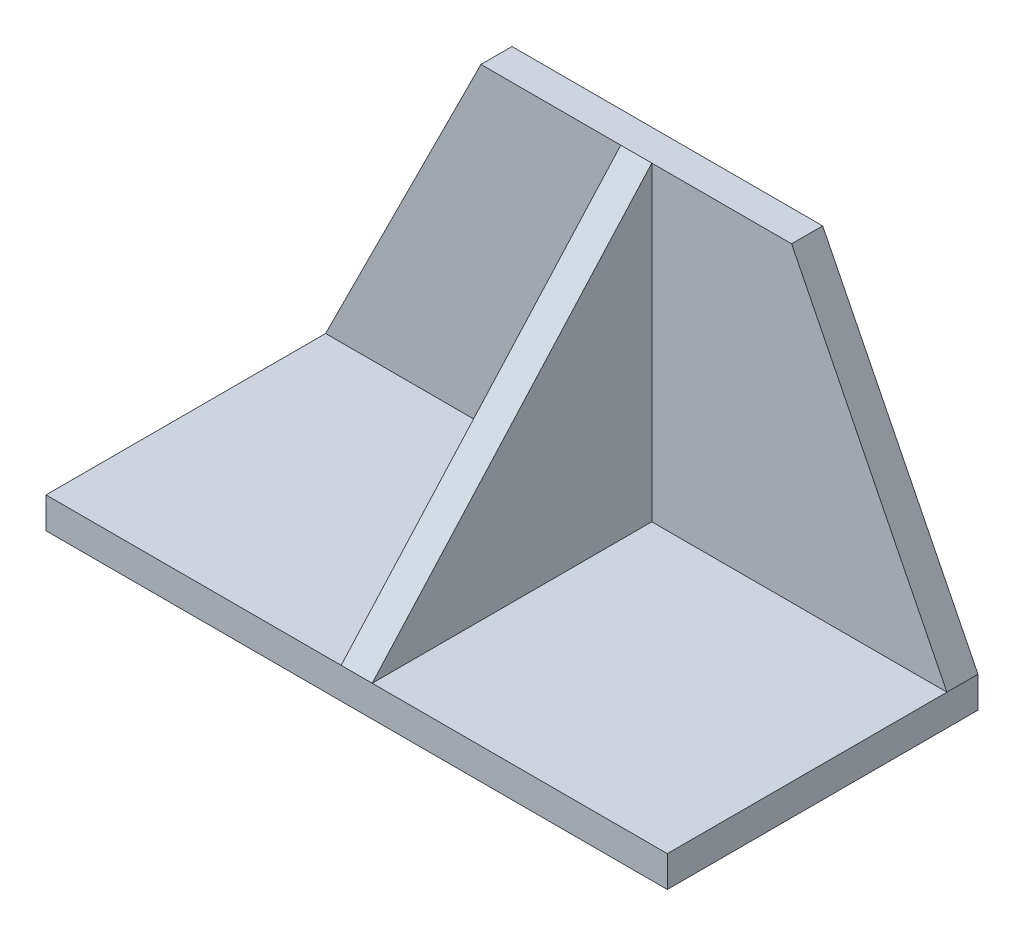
SolidWorks part; units mm, degrees
ref_plane "Front Plane" through (0, 0, 0) normal (0, 0, 1) x (1, 0, 0)
ref_plane "Top Plane" through (0, 0, 0) normal (0, 1, 0) x (1, 0, 0)
ref_plane "Right Plane" through (0, 0, 0) normal (1, 0, 0) x (0, 0, -1)
sketch "Sketch1" plane through (0, 0, 0) normal (0, 1, 0) x (1, 0, 0)
  line L0 (-25.4, -12.7) -> (25.4, 12.7) construction
  line L1 (-25.4, -12.7) -> (25.4, -12.7)
  line L2 (-25.4, -12.7) -> (-25.4, 12.7)
  line L3 (-25.4, 12.7) -> (25.4, 12.7)
  line L4 (25.4, -12.7) -> (25.4, 12.7)
  dimension "D1" = 50.8
  dimension "D2" = 25.4
extrude "Extrude1" add sketch "Sketch1" against normal blind 2.54
sketch "Sketch2" plane through (0, 0, -12.7) normal (0, 0, -1) x (-1, 0, 0)
  line L0 (-25.4, 0) -> (25.4, 0)
  line L1 (-25.4, 0) -> (-12.7, 25.4)
  line L2 (-12.7, 25.4) -> (12.7, 25.4)
  line L3 (12.7, 25.4) -> (25.4, 0)
  dimension "D1" = 25.4
  dimension "D2" = 25.4
extrude "Extrude2" add sketch "Sketch2" against normal blind 2.54
sketch "Sketch4" plane through (0, 0, 0) normal (1, 0, 0) x (0, 0, -1)
  line L0 (-12.7, 0) -> (10.16, 25.4)
  line L1 (-12.7, 0) -> (10.16, 0) construction
  line L2 (10.16, 25.4) -> (10.16, 0) construction
rib "Rib4" sketch "Sketch4" sketch "Sketch4" thickness 2.54 extrusion direction parallel to sketch draft on no parameters "D1"=2.54
